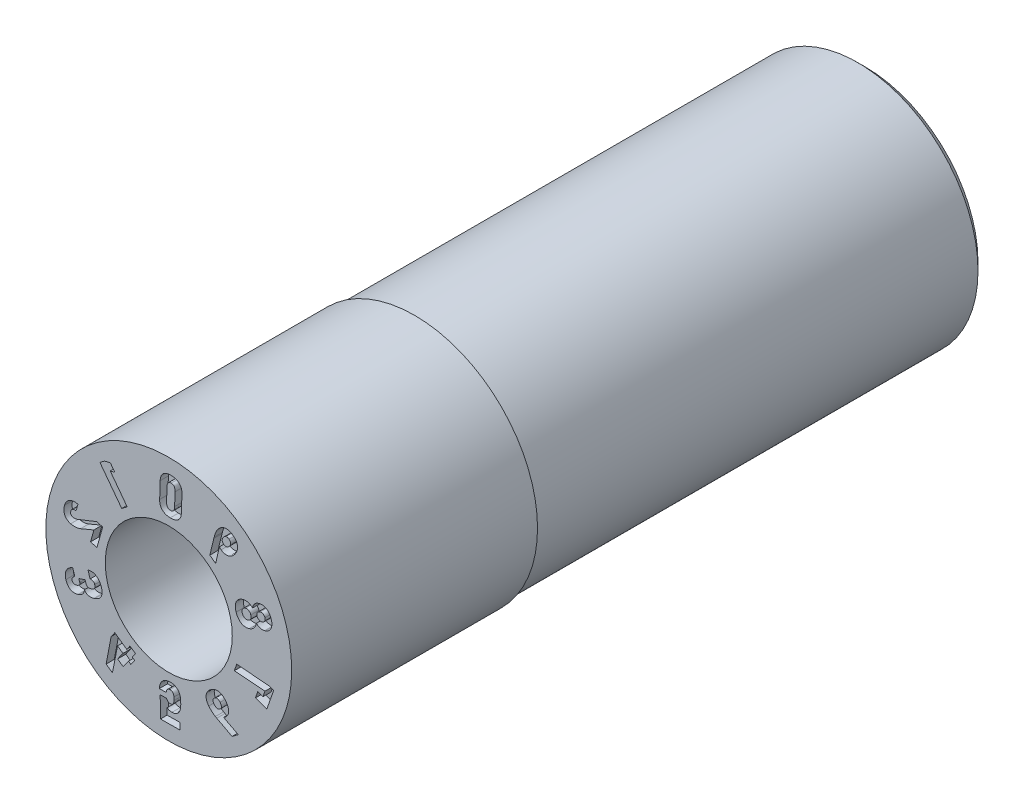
SolidWorks part; units mm, degrees
ref_plane "Front Plane" through (0, 0, 0) normal (0, 0, 1) x (1, 0, 0)
ref_plane "Top Plane" through (0, 0, 0) normal (0, 1, 0) x (1, 0, 0)
ref_plane "Right Plane" through (0, 0, 0) normal (1, 0, 0) x (0, 0, -1)
sketch "Sketch1" plane through (0, 0, 0) normal (1, 0, 0) x (0, 0, -1)
  line L2 (0, 3) -> (0, 1.55)
  line L3 (16.75, 3) -> (0, 3)
  line L4 (-3.7979, 0) -> (49996.2021, 0) construction
  line L8 (14, 0.8) -> (2.8, 0.8)
  line L9 (2.8, 1.55) -> (2.8, 0.8)
  line L10 (2.8, 1.55) -> (0, 1.55)
  line L12 (17, 1.5) -> (17, 2.75)
  line L16 (17, 2.75) -> (16.75, 3)
  line L17 (17, 1.5) -> (14, 1.5)
  line L18 (14, 0.8) -> (14, 1.5)
  dimension "D1" = 17
  dimension "D2" = 45
  dimension "D3" = 0.25
  dimension "D4" = 6
  dimension "D5" = 3.1
  dimension "D6" = 2.8
  dimension "D7" = 1.6
  dimension "D8" = 3
  dimension "D9" = 3
revolve "Revolve1" add sketch "Sketch1" angle 360 about L4
sketch "Sketch4" plane through (0, 0, 0) normal (1, 0, 0) x (0, 0, -1)
  line L0 (0, 0) -> (50000, 0) construction
  line L1 (17, -2.75) -> (17, 2.75) construction
  line L2 (6, 3.935) -> (17, 3.935)
  line L3 (6, 3.935) -> (6, 2.935)
  line L4 (6, 2.935) -> (17, 2.935)
  line L5 (17, 3.935) -> (17, 2.935)
  line L6 (16.75, 3) -> (0, 3) construction
  line L9 (0, 55) -> (0, -55) construction
  dimension "D1" = 1
  dimension "D2" = 0.065
  dimension "D3" = 6
revolve "Cut-Revolve1" cut sketch "Sketch4" angle 360 about L0
sketch "Sketch2" plane through (0, 0, 0) normal (0, 0, 1) x (1, 0, 0)
  line L0 (0, 3.7423) -> (0, 0) construction
  line L1 (2.1997, 3.0276) -> (0, 0) construction
  line L2 (3.5591, 1.1564) -> (0, 0) construction
  line L3 (3.5591, -1.1564) -> (0, 0) construction
  line L4 (2.1997, -3.0276) -> (0, 0) construction
  line L5 (0, -3.7423) -> (0, 0) construction
  line L6 (-2.1997, -3.0276) -> (0, 0) construction
  line L7 (-3.5591, -1.1564) -> (0, 0) construction
  line L8 (-3.5591, 1.1564) -> (0, 0) construction
  line L9 (-2.1997, 3.0276) -> (0, 0) construction
  line L10 (1.9646, 0.3603) -> (1.9783, 0.3649)
  line L11 (2.3396, 0.5043) -> (2.3614, 0.5117)
  line L12 (2.1957, 1.0088) -> (2.1739, 1.0014)
  line L13 (1.8012, 0.8965) -> (1.7875, 0.8918)
  line L14 (1.8631, 0.7416) -> (1.8712, 0.7443)
  line L15 (1.9425, 0.5285) -> (1.9338, 0.5256)
  line L16 (2.2203, 0.8413) -> (2.2282, 0.8439)
  line L17 (2.2879, 0.6627) -> (2.2792, 0.6598)
  line L18 (-1.0256, -1.574) -> (-1.3171, -1.3669)
  line L19 (1.614, 1.759) -> (1.6145, 1.7595)
  line L20 (1.1924, 2.0656) -> (1.1921, 2.0653)
  line L21 (1.0993, 1.8332) -> (1.0018, 1.4312)
  line L22 (1.0018, 1.4312) -> (1.145, 1.3261)
  line L23 (1.145, 1.3261) -> (1.2344, 1.7241)
  line L24 (1.332, 1.9723) -> (1.3324, 1.9728)
  line L25 (1.4816, 1.8624) -> (1.4812, 1.8618)
  line L26 (0.3085, 1.9801) -> (0.3215, 2.3834)
  line L27 (-0.2092, 2.4005) -> (-0.2221, 1.9973)
  line L28 (-0.0536, 2.0347) -> (-0.0433, 2.3524)
  line L29 (0.153, 2.3462) -> (0.1427, 2.0284)
  line L30 (-1.1478, 1.3435) -> (-1.0146, 1.4437)
  line L31 (-1.0146, 1.4437) -> (-1.4288, 1.9942)
  line L32 (-1.4288, 1.9942) -> (-1.3183, 2.0264)
  line L33 (-1.3183, 2.0264) -> (-1.4248, 2.1678)
  line L34 (-1.4248, 2.1678) -> (-1.5662, 2.1362)
  line L35 (-1.5662, 2.1362) -> (-1.68, 2.0505)
  line L36 (-1.68, 2.0505) -> (-1.1478, 1.3435)
  line L37 (-1.7573, 0.7596) -> (-2.2252, 0.5745)
  line L38 (-2.341, 0.5619) -> (-2.3422, 0.5622)
  line L39 (-2.2634, 0.7349) -> (-2.2627, 0.7346)
  line L40 (-2.2627, 0.7346) -> (-2.2164, 0.8998)
  line L41 (-2.2164, 0.8998) -> (-2.2171, 0.9)
  line L42 (-2.3935, 0.398) -> (-2.3928, 0.3977)
  line L43 (-2.152, 0.4133) -> (-1.8273, 0.5491)
  line L44 (-1.8273, 0.5491) -> (-1.9093, 0.257)
  line L45 (-1.9093, 0.257) -> (-1.7541, 0.2134)
  line L46 (-1.7541, 0.2134) -> (-1.6121, 0.7188)
  line L47 (-1.6121, 0.7188) -> (-1.7573, 0.7596)
  line L48 (-1.9727, -0.3677) -> (-1.9191, -0.5323)
  line L49 (-1.8737, -0.7209) -> (-1.8936, -0.7273)
  line L50 (-2.0193, -0.6828) -> (-2.0426, -0.6111)
  line L51 (-2.0426, -0.6111) -> (-2.1963, -0.6611)
  line L52 (-2.1963, -0.6611) -> (-2.173, -0.7328)
  line L53 (-2.2397, -0.8247) -> (-2.2541, -0.8294)
  line L54 (-2.2928, -0.669) -> (-2.3462, -0.5049)
  line L55 (-2.2148, -1.0057) -> (-2.189, -0.9973)
  line L56 (-1.8257, -0.8946) -> (-1.8, -0.8862)
  line L57 (-1.4061, -1.492) -> (-1.5288, -2.1359)
  line L58 (-1.5288, -2.1359) -> (-1.3748, -2.2452)
  line L59 (-1.3748, -2.2452) -> (-1.2504, -1.6116)
  line L60 (-1.2504, -1.6116) -> (-1.1187, -1.7051)
  line L61 (-0.9261, -1.8421) -> (-0.8329, -1.7109)
  line L62 (-0.8329, -1.7109) -> (-0.8896, -1.6707)
  line L63 (-1.3171, -1.3669) -> (-1.4061, -1.492)
  line L64 (-1.2486, -1.8878) -> (-1.1126, -1.9845)
  line L65 (-1.1126, -1.9845) -> (-0.9828, -1.8018)
  line L66 (-0.8105, -1.5594) -> (-0.9465, -1.4627)
  line L67 (-0.9465, -1.4627) -> (-1.0256, -1.574)
  line L68 (-0.23, -2.0036) -> (-0.23, -2.0042)
  line L69 (-0.23, -2.0042) -> (-0.0627, -2.0022)
  line L70 (-0.0627, -2.0022) -> (-0.0627, -2.0017)
  line L71 (0.1247, -2.0061) -> (0.1256, -2.0805)
  line L72 (-0.0528, -2.1224) -> (-0.2091, -2.1242)
  line L73 (-0.2091, -2.1242) -> (-0.2029, -2.6344)
  line L74 (-0.2029, -2.6344) -> (0.2738, -2.6287)
  line L75 (0.2738, -2.6287) -> (0.2719, -2.4676)
  line L76 (0.2719, -2.4676) -> (-0.0376, -2.4713)
  line L77 (-0.0376, -2.4713) -> (-0.0394, -2.3145)
  line L78 (0.2927, -2.0785) -> (0.2918, -2.0042)
  line L79 (0.9754, -1.7698) -> (0.9758, -1.7704)
  line L80 (1.1719, -1.9302) -> (1.5442, -2.1282)
  line L81 (1.5442, -2.1282) -> (1.6957, -2.0151)
  line L82 (1.6957, -2.0151) -> (1.3383, -1.8295)
  line L83 (-1.1187, -1.7051) -> (-1.2486, -1.8878)
  line L84 (1.3929, -1.4625) -> (1.3925, -1.462)
  line L85 (1.2526, -1.5536) -> (1.253, -1.5541)
  line L86 (1.1047, -1.664) -> (1.1043, -1.6635)
  line L87 (2.4557, -0.6107) -> (1.6591, -0.5429)
  line L88 (1.6591, -0.5429) -> (1.5995, -0.7135)
  line L89 (1.5995, -0.7135) -> (2.3471, -0.7708)
  line L90 (2.3471, -0.7708) -> (2.2969, -0.9145)
  line L91 (2.2969, -0.9145) -> (2.171, -0.8706)
  line L92 (2.171, -0.8706) -> (2.116, -1.0281)
  line L93 (2.116, -1.0281) -> (2.3936, -1.1249)
  line L94 (2.3936, -1.1249) -> (2.5604, -0.6471)
  line L95 (2.5604, -0.6471) -> (2.4557, -0.6107)
  line L96 (-0.9828, -1.8018) -> (-0.9261, -1.8421)
  line L97 (-0.8896, -1.6707) -> (-0.8105, -1.5594)
  circle A0 centre (0, 0) radius 1.7759 construction
  spline S0 degree 3 poles (1.643, 0.5484) (1.6514, 0.5233) (1.6669, 0.4876) (1.6945, 0.4451) (1.7177, 0.418) (1.7429, 0.3946) (1.7705, 0.3758) (1.7999, 0.3613) (1.831, 0.3515) (1.8634, 0.3462) (1.9087, 0.3456) (1.9426, 0.3531) (1.9646, 0.3603) knots 0 0 0 0 0.189149 0.276864 0.361539 0.443576 0.522394 0.599725 0.677022 0.754789 0.833795 1 1 1 1
  spline S1 degree 3 poles (1.9783, 0.3649) (1.999, 0.3717) (2.0286, 0.3863) (2.0628, 0.414) (2.0857, 0.4384) (2.1052, 0.4657) (2.1263, 0.5048) (2.1349, 0.5371) (2.1379, 0.5589) knots 0 0 0 0 0.246977 0.370172 0.497924 0.625566 0.750117 1 1 1 1
  spline S2 degree 3 poles (2.1379, 0.5589) (2.1511, 0.5454) (2.1734, 0.528) (2.207, 0.5111) (2.2334, 0.502) (2.2605, 0.4964) (2.2964, 0.4941) (2.3228, 0.4988) (2.3396, 0.5043) knots 0 0 0 0 0.257134 0.383027 0.511099 0.637625 0.759671 1 1 1 1
  spline S3 degree 3 poles (2.3614, 0.5117) (2.3821, 0.5188) (2.4119, 0.5322) (2.4458, 0.5582) (2.4672, 0.5806) (2.4854, 0.6054) (2.4993, 0.633) (2.5096, 0.6626) (2.5156, 0.6942) (2.5178, 0.7275) (2.5151, 0.7748) (2.5063, 0.8102) (2.4986, 0.8335) knots 0 0 0 0 0.16714 0.246142 0.324291 0.402157 0.479801 0.558525 0.640149 0.724487 0.812253 1 1 1 1
  spline S4 degree 3 poles (2.4986, 0.8335) (2.4907, 0.8569) (2.4765, 0.8905) (2.4503, 0.93) (2.4286, 0.9553) (2.4048, 0.977) (2.3788, 0.9945) (2.3511, 1.008) (2.3218, 1.0172) (2.2912, 1.0221) (2.2485, 1.0224) (2.2165, 1.0157) (2.1957, 1.0088) knots 0 0 0 0 0.188263 0.275658 0.360332 0.441745 0.520456 0.597882 0.675873 0.753814 0.833078 1 1 1 1
  spline S5 degree 3 poles (2.1739, 1.0014) (2.1568, 0.996) (2.1329, 0.9832) (2.1049, 0.96) (2.0869, 0.9389) (2.0712, 0.9156) (2.0551, 0.8815) (2.048, 0.854) (2.0459, 0.8351) knots 0 0 0 0 0.242123 0.364086 0.490249 0.617698 0.743096 1 1 1 1
  spline S6 degree 3 poles (2.0459, 0.8351) (2.0303, 0.8511) (2.0037, 0.8718) (1.9632, 0.891) (1.9311, 0.9013) (1.8982, 0.9074) (1.8543, 0.9092) (1.8219, 0.9032) (1.8012, 0.8965) knots 0 0 0 0 0.252199 0.377454 0.505058 0.631379 0.754394 1 1 1 1
  spline S7 degree 3 poles (1.7875, 0.8918) (1.7655, 0.8844) (1.734, 0.8699) (1.698, 0.8423) (1.6753, 0.8186) (1.6562, 0.7921) (1.6414, 0.7629) (1.631, 0.7313) (1.6243, 0.6975) (1.6222, 0.6619) (1.6255, 0.6113) (1.6345, 0.5734) (1.643, 0.5484) knots 0 0 0 0 0.166586 0.245064 0.32325 0.400569 0.477895 0.55635 0.638171 0.723193 0.810971 1 1 1 1
  spline S8 degree 3 poles (1.7953, 0.5991) (1.792, 0.6091) (1.7884, 0.6244) (1.7879, 0.6449) (1.7891, 0.6596) (1.7924, 0.6736) (1.7974, 0.6868) (1.8045, 0.6989) (1.8131, 0.7102) (1.8236, 0.7203) (1.8397, 0.7319) (1.8533, 0.7386) (1.8631, 0.7416) knots 0 0 0 0 0.178659 0.263512 0.345804 0.426862 0.506071 0.58371 0.664092 0.745271 0.827853 1 1 1 1
  spline S9 degree 3 poles (1.8712, 0.7443) (1.8801, 0.7473) (1.8939, 0.7502) (1.9122, 0.7497) (1.9253, 0.7474) (1.9379, 0.7433) (1.9499, 0.7374) (1.961, 0.7298) (1.9714, 0.7206) (1.9806, 0.7096) (1.9922, 0.6927) (1.9982, 0.6781) (2.0017, 0.668) knots 0 0 0 0 0.166218 0.24509 0.322722 0.400755 0.478423 0.557267 0.638758 0.723097 0.810568 1 1 1 1
  spline S10 degree 3 poles (2.0017, 0.668) (2.0049, 0.6578) (2.0089, 0.6425) (2.0099, 0.622) (2.0089, 0.6077) (2.0064, 0.5939) (2.0019, 0.581) (1.9958, 0.5691) (1.988, 0.5582) (1.9788, 0.5485) (1.9642, 0.5373) (1.9515, 0.5314) (1.9425, 0.5285) knots 0 0 0 0 0.188381 0.275514 0.359781 0.441669 0.521149 0.598996 0.676873 0.75539 0.833936 1 1 1 1
  spline S11 degree 3 poles (1.9338, 0.5256) (1.9241, 0.5223) (1.9093, 0.5192) (1.8895, 0.5188) (1.8754, 0.5209) (1.8618, 0.5247) (1.8491, 0.5304) (1.8371, 0.5377) (1.8263, 0.5471) (1.8165, 0.5579) (1.8053, 0.5749) (1.7985, 0.589) (1.7953, 0.5991) knots 0 0 0 0 0.173702 0.255121 0.336326 0.416102 0.493685 0.572899 0.653754 0.736097 0.820278 1 1 1 1
  spline S12 degree 3 poles (2.1551, 0.719) (2.1522, 0.7275) (2.1493, 0.7406) (2.1491, 0.7581) (2.1507, 0.7705) (2.1542, 0.7823) (2.1589, 0.7936) (2.1656, 0.8039) (2.1737, 0.8137) (2.1834, 0.8223) (2.1985, 0.8326) (2.2112, 0.8384) (2.2203, 0.8413) knots 0 0 0 0 0.173002 0.255064 0.334564 0.413146 0.490488 0.568625 0.649591 0.733329 0.818008 1 1 1 1
  spline S13 degree 3 poles (2.2282, 0.8439) (2.2367, 0.8466) (2.2494, 0.8496) (2.2664, 0.8498) (2.2785, 0.8484) (2.2899, 0.8452) (2.3007, 0.8406) (2.3108, 0.8345) (2.32, 0.8267) (2.3283, 0.8177) (2.3384, 0.8035) (2.3435, 0.7912) (2.3465, 0.7828) knots 0 0 0 0 0.177307 0.259345 0.339545 0.418685 0.496491 0.574446 0.653742 0.736205 0.819476 1 1 1 1
  spline S14 degree 3 poles (2.3465, 0.7828) (2.3492, 0.7742) (2.3526, 0.7612) (2.3528, 0.7438) (2.3517, 0.7315) (2.3488, 0.7199) (2.3446, 0.7088) (2.3386, 0.6986) (2.331, 0.6893) (2.3221, 0.6809) (2.3083, 0.6707) (2.2962, 0.6656) (2.2879, 0.6627) knots 0 0 0 0 0.179779 0.264113 0.345718 0.425073 0.502738 0.58081 0.660047 0.741093 0.823978 1 1 1 1
  spline S15 degree 3 poles (2.2792, 0.6598) (2.2705, 0.657) (2.257, 0.6539) (2.2391, 0.6533) (2.2263, 0.6543) (2.2143, 0.6573) (2.2028, 0.6616) (2.1923, 0.6676) (2.1825, 0.6752) (2.1737, 0.6841) (2.1635, 0.6982) (2.1581, 0.7105) (2.1551, 0.719) knots 0 0 0 0 0.179106 0.264699 0.346614 0.427117 0.504294 0.583324 0.662147 0.74231 0.825294 1 1 1 1
  spline S16 degree 3 poles (1.2344, 1.7241) (1.2348, 1.7235) (1.239, 1.7181) (1.252, 1.7028) (1.267, 1.6904) (1.2775, 1.6825) knots 0.564808 0.564808 0.564808 0.564808 0.581367 0.712724 1 1 1 1
  spline S17 degree 3 poles (1.2775, 1.6825) (1.2947, 1.6699) (1.3224, 1.6543) (1.3621, 1.6421) (1.3921, 1.6378) (1.4222, 1.6379) (1.4522, 1.6427) (1.4819, 1.6516) (1.5109, 1.665) (1.539, 1.6826) (1.5756, 1.7122) (1.5995, 1.7393) (1.614, 1.759) knots 0 0 0 0 0.164897 0.243134 0.320511 0.39795 0.475691 0.554489 0.636785 0.722171 0.810484 1 1 1 1
  spline S18 degree 3 poles (1.6145, 1.7595) (1.6301, 1.7813) (1.651, 1.8146) (1.6694, 1.862) (1.6778, 1.8961) (1.6813, 1.9297) (1.6794, 1.9624) (1.6728, 1.9943) (1.6608, 2.025) (1.6443, 2.0548) (1.6146, 2.0936) (1.5862, 2.1184) (1.5655, 2.1337) knots 0 0 0 0 0.187702 0.272979 0.354472 0.432702 0.508274 0.583207 0.65927 0.738162 0.82033 1 1 1 1
  spline S19 degree 3 poles (1.5655, 2.1337) (1.5449, 2.1486) (1.5128, 2.1683) (1.4668, 2.1845) (1.4334, 2.1915) (1.4002, 2.1934) (1.3676, 2.19) (1.3356, 2.1814) (1.3044, 2.168) (1.2742, 2.1495) (1.2344, 2.1172) (1.2082, 2.0876) (1.1924, 2.0656) knots 0 0 0 0 0.177888 0.259816 0.338331 0.414817 0.490131 0.565735 0.64425 0.726092 0.811434 1 1 1 1
  spline S20 degree 3 poles (1.1921, 2.0653) (1.1828, 2.0528) (1.1702, 2.0324) (1.1554, 2.0034) (1.145, 1.9794) (1.1352, 1.9539) (1.122, 1.9169) (1.114, 1.8879) (1.1084, 1.8681) knots 0 0 0 0 0.216887 0.332679 0.453535 0.580869 0.713539 1 1 1 1
  spline S21 degree 3 poles (1.1084, 1.8681) (1.1065, 1.8623) (1.1035, 1.8506) (1.1003, 1.839) (1.0993, 1.8332) knots 0 0 0 0 0.506531 1 1 1 1
  spline S22 degree 3 poles (1.3422, 1.8296) (1.3315, 1.8374) (1.3172, 1.8514) (1.3065, 1.8748) (1.303, 1.8931) (1.304, 1.9124) (1.3111, 1.9403) (1.323, 1.9597) (1.332, 1.9723) knots 0 0 0 0 0.246295 0.358616 0.470672 0.58763 0.712559 1 1 1 1
  spline S23 degree 3 poles (1.3324, 1.9728) (1.3412, 1.985) (1.3561, 2.0008) (1.3797, 2.0156) (1.3975, 2.0214) (1.4157, 2.0232) (1.4409, 2.0195) (1.4585, 2.0105) (1.4691, 2.0024) knots 0 0 0 0 0.283785 0.405908 0.522128 0.634955 0.748097 1 1 1 1
  spline S24 degree 3 poles (1.4691, 2.0024) (1.4799, 1.9945) (1.4944, 1.9806) (1.5054, 1.9573) (1.5089, 1.9392) (1.5083, 1.9204) (1.5017, 1.8933) (1.4902, 1.8746) (1.4816, 1.8624) knots 0 0 0 0 0.252476 0.366872 0.479602 0.595681 0.718088 1 1 1 1
  spline S25 degree 3 poles (1.4812, 1.8618) (1.4719, 1.8495) (1.4571, 1.8323) (1.4326, 1.8175) (1.4146, 1.8107) (1.3962, 1.8088) (1.3706, 1.8122) (1.3529, 1.8215) (1.3422, 1.8296) knots 0 0 0 0 0.286977 0.411209 0.527402 0.638802 0.751662 1 1 1 1
  spline S26 degree 3 poles (0.0349, 1.7367) (0.0554, 1.7362) (0.0853, 1.7368) (0.1236, 1.7427) (0.1496, 1.7493) (0.1738, 1.7579) (0.1961, 1.7687) (0.2166, 1.7816) (0.2351, 1.7968) (0.2515, 1.8139) (0.2659, 1.8327) (0.2783, 1.8531) (0.2886, 1.8753) (0.2968, 1.8992) (0.305, 1.9341) (0.308, 1.9614) (0.3085, 1.9801) knots 0 0 0 0 0.147137 0.214358 0.278606 0.339919 0.398926 0.456935 0.513792 0.570649 0.626987 0.684089 0.742428 0.802687 0.865483 1 1 1 1
  spline S27 degree 3 poles (0.3215, 2.3834) (0.3219, 2.4022) (0.3214, 2.43) (0.315, 2.4655) (0.3084, 2.49) (0.2997, 2.5129) (0.2887, 2.5341) (0.2755, 2.5538) (0.26, 2.5716) (0.2424, 2.5878) (0.2228, 2.602) (0.2012, 2.6141) (0.1777, 2.6243) (0.1522, 2.6323) (0.1144, 2.6404) (0.0847, 2.6432) (0.0644, 2.6439) knots 0 0 0 0 0.135819 0.198843 0.259322 0.317796 0.3747 0.43116 0.487607 0.544517 0.602364 0.661319 0.722276 0.78613 0.853499 1 1 1 1
  spline S28 degree 3 poles (0.0644, 2.6439) (0.044, 2.6444) (0.014, 2.644) (-0.0242, 2.6378) (-0.0503, 2.6319) (-0.0744, 2.623) (-0.0968, 2.6125) (-0.1172, 2.5998) (-0.1357, 2.5848) (-0.1522, 2.5679) (-0.1667, 2.5493) (-0.1789, 2.5287) (-0.1893, 2.5066) (-0.1974, 2.4825) (-0.2061, 2.4473) (-0.2084, 2.4195) (-0.2092, 2.4005) knots 0 0 0 0 0.146922 0.214045 0.277959 0.339182 0.3979 0.455579 0.512067 0.568196 0.624703 0.681512 0.739766 0.800352 0.863566 1 1 1 1
  spline S29 degree 3 poles (-0.2221, 1.9973) (-0.2226, 1.9784) (-0.2221, 1.9507) (-0.2157, 1.9151) (-0.2091, 1.8907) (-0.2004, 1.8678) (-0.1892, 1.8467) (-0.1759, 1.827) (-0.1605, 1.809) (-0.1429, 1.7929) (-0.1235, 1.7786) (-0.1018, 1.7666) (-0.0783, 1.7564) (-0.0528, 1.7484) (-0.015, 1.7403) (0.0146, 1.7375) (0.0349, 1.7367) knots 0 0 0 0 0.135853 0.198892 0.259386 0.317476 0.37461 0.431085 0.487863 0.544787 0.602288 0.661258 0.722634 0.786504 0.853463 1 1 1 1
  spline S30 degree 3 poles (0.0402, 1.8978) (0.0323, 1.8983) (0.0207, 1.8991) (0.0063, 1.9037) (-0.0035, 1.9075) (-0.0121, 1.9129) (-0.0202, 1.9189) (-0.0271, 1.9264) (-0.0354, 1.9377) (-0.0435, 1.9547) (-0.0534, 1.9879) (-0.0537, 2.0156) (-0.0536, 2.0347) knots 0 0 0 0 0.125945 0.183291 0.238413 0.291967 0.344823 0.3983 0.452118 0.567781 0.695223 1 1 1 1
  spline S31 degree 3 poles (-0.0433, 2.3524) (-0.0425, 2.3715) (-0.0401, 2.399) (-0.0283, 2.4315) (-0.0189, 2.4479) (-0.0099, 2.4586) (-0.0025, 2.4656) (0.0059, 2.4711) (0.0149, 2.4761) (0.0249, 2.4794) (0.0396, 2.4825) (0.0512, 2.4833) (0.0591, 2.4829) knots 0 0 0 0 0.304248 0.431958 0.547131 0.601686 0.654466 0.707868 0.761045 0.816491 0.873821 1 1 1 1
  spline S32 degree 3 poles (0.0591, 2.4829) (0.0671, 2.4829) (0.0786, 2.4812) (0.0931, 2.4773) (0.1027, 2.473) (0.1117, 2.4681) (0.1194, 2.4616) (0.1265, 2.4544) (0.1348, 2.443) (0.1431, 2.4261) (0.1525, 2.3928) (0.1532, 2.3653) (0.153, 2.3462) knots 0 0 0 0 0.126048 0.183166 0.238633 0.292583 0.345235 0.398052 0.45322 0.568053 0.695199 1 1 1 1
  spline S33 degree 3 poles (0.1427, 2.0284) (0.142, 2.0093) (0.1392, 1.9819) (0.1279, 1.9491) (0.1184, 1.9328) (0.1094, 1.9219) (0.1018, 1.9152) (0.0936, 1.9094) (0.0844, 1.9049) (0.0745, 1.9012) (0.0597, 1.8982) (0.0481, 1.8973) (0.0402, 1.8978) knots 0 0 0 0 0.303869 0.432041 0.54707 0.601557 0.654952 0.707519 0.76099 0.81672 0.873978 1 1 1 1
  spline S34 degree 3 poles (-2.2252, 0.5745) (-2.245, 0.5667) (-2.2706, 0.5594) (-2.3015, 0.5576) (-2.3197, 0.5573) (-2.3327, 0.5599) (-2.341, 0.5619) knots 0 0 0 0 0.540719 0.665819 0.783787 1 1 1 1
  spline S35 degree 3 poles (-2.3422, 0.5622) (-2.3526, 0.5652) (-2.3673, 0.5719) (-2.3822, 0.5865) (-2.3899, 0.5996) (-2.3949, 0.6144) (-2.397, 0.6379) (-2.3938, 0.6561) (-2.3903, 0.6684) knots 0 0 0 0 0.245533 0.356637 0.46917 0.585599 0.709489 1 1 1 1
  spline S36 degree 3 poles (-2.3903, 0.6684) (-2.3867, 0.6806) (-2.379, 0.6983) (-2.3615, 0.7162) (-2.3461, 0.7265) (-2.3283, 0.7334) (-2.3005, 0.739) (-2.2784, 0.7369) (-2.2634, 0.7349) knots 0 0 0 0 0.241005 0.354164 0.46819 0.587648 0.713238 1 1 1 1
  spline S37 degree 3 poles (-2.2171, 0.9) (-2.2426, 0.9054) (-2.2807, 0.91) (-2.3306, 0.9073) (-2.3651, 0.901) (-2.3975, 0.8906) (-2.4273, 0.8761) (-2.4545, 0.8578) (-2.4791, 0.8357) (-2.5005, 0.8098) (-2.5256, 0.7701) (-2.5386, 0.7365) (-2.5452, 0.7132) knots 0 0 0 0 0.185279 0.271235 0.354096 0.434334 0.512208 0.589109 0.666944 0.746227 0.827242 1 1 1 1
  spline S38 degree 3 poles (-2.5452, 0.7132) (-2.5522, 0.6883) (-2.5596, 0.6513) (-2.5611, 0.6027) (-2.5583, 0.5695) (-2.5513, 0.5386) (-2.5402, 0.51) (-2.525, 0.4841) (-2.506, 0.4608) (-2.4832, 0.4403) (-2.4469, 0.4162) (-2.4155, 0.4041) (-2.3935, 0.398) knots 0 0 0 0 0.195042 0.283139 0.36646 0.445986 0.522022 0.596986 0.671869 0.748307 0.827593 1 1 1 1
  spline S39 degree 3 poles (-2.3928, 0.3977) (-2.3734, 0.3923) (-2.3435, 0.3867) (-2.3028, 0.3845) (-2.2717, 0.3854) (-2.2407, 0.3885) (-2.2001, 0.396) (-2.1709, 0.4056) (-2.152, 0.4133) knots 0 0 0 0 0.245803 0.370307 0.497524 0.625183 0.750822 1 1 1 1
  spline S40 degree 3 poles (-1.6475, -0.5618) (-1.6554, -0.5375) (-1.6702, -0.5027) (-1.6968, -0.461) (-1.7193, -0.4339) (-1.7442, -0.4104) (-1.7714, -0.3908) (-1.801, -0.3756) (-1.8325, -0.3643) (-1.8659, -0.3578) (-1.9132, -0.3552) (-1.9491, -0.3613) (-1.9727, -0.3677) knots 0 0 0 0 0.181239 0.266564 0.349497 0.429986 0.508511 0.586299 0.665102 0.745038 0.826222 1 1 1 1
  spline S41 degree 3 poles (-1.9191, -0.5323) (-1.9105, -0.5306) (-1.8977, -0.5296) (-1.8811, -0.5305) (-1.8696, -0.533) (-1.8588, -0.5365) (-1.8489, -0.5414) (-1.8398, -0.5474) (-1.8315, -0.5546) (-1.8242, -0.563) (-1.8151, -0.5758) (-1.8106, -0.587) (-1.808, -0.5947) knots 0 0 0 0 0.186215 0.271746 0.354623 0.435117 0.513799 0.58974 0.667057 0.745561 0.826556 1 1 1 1
  spline S42 degree 3 poles (-1.808, -0.5947) (-1.8039, -0.6082) (-1.7994, -0.629) (-1.8032, -0.6558) (-1.8099, -0.6735) (-1.8205, -0.689) (-1.8406, -0.7075) (-1.86, -0.7164) (-1.8737, -0.7209) knots 0 0 0 0 0.265552 0.38416 0.498069 0.612278 0.730215 1 1 1 1
  spline S43 degree 3 poles (-1.8936, -0.7273) (-1.908, -0.7321) (-1.9293, -0.7368) (-1.9569, -0.7363) (-1.9746, -0.7323) (-1.9899, -0.7249) (-2.0076, -0.71) (-2.0155, -0.6939) (-2.0193, -0.6828) knots 0 0 0 0 0.300175 0.428716 0.546215 0.657116 0.764967 1 1 1 1
  spline S44 degree 3 poles (-2.173, -0.7328) (-2.1699, -0.742) (-2.1683, -0.7565) (-2.1731, -0.7751) (-2.1806, -0.7875) (-2.1908, -0.7992) (-2.2101, -0.8132) (-2.2272, -0.8209) (-2.2397, -0.8247) knots 0 0 0 0 0.226275 0.333176 0.444771 0.564289 0.694381 1 1 1 1
  spline S45 degree 3 poles (-2.2541, -0.8294) (-2.2657, -0.8331) (-2.2831, -0.8372) (-2.3058, -0.8354) (-2.3204, -0.8313) (-2.3333, -0.8241) (-2.3481, -0.8102) (-2.3552, -0.796) (-2.3585, -0.7861) knots 0 0 0 0 0.287214 0.411059 0.528164 0.640053 0.753005 1 1 1 1
  spline S46 degree 3 poles (-2.3585, -0.7861) (-2.3609, -0.7792) (-2.3626, -0.7684) (-2.3622, -0.7538) (-2.3602, -0.7431) (-2.3568, -0.7324) (-2.3517, -0.7221) (-2.3456, -0.712) (-2.3378, -0.7024) (-2.3285, -0.6933) (-2.3141, -0.6811) (-2.3014, -0.6738) (-2.2928, -0.669) knots 0 0 0 0 0.149486 0.221379 0.296505 0.372837 0.450101 0.530551 0.614358 0.702677 0.796538 1 1 1 1
  spline S47 degree 3 poles (-2.3462, -0.5049) (-2.3697, -0.5152) (-2.4035, -0.5329) (-2.4421, -0.564) (-2.4666, -0.5891) (-2.4869, -0.6166) (-2.5035, -0.6454) (-2.5152, -0.6762) (-2.5232, -0.708) (-2.5267, -0.741) (-2.5253, -0.7864) (-2.5186, -0.8202) (-2.5112, -0.8421) knots 0 0 0 0 0.185633 0.272058 0.356309 0.437961 0.517155 0.595271 0.674069 0.753305 0.833466 1 1 1 1
  spline S48 degree 3 poles (-2.5112, -0.8421) (-2.5052, -0.8598) (-2.4955, -0.8854) (-2.4784, -0.9164) (-2.465, -0.9371) (-2.4498, -0.9554) (-2.4338, -0.9718) (-2.4162, -0.9858) (-2.3976, -0.9976) (-2.3778, -1.0072) (-2.357, -1.0142) (-2.3353, -1.0191) (-2.3128, -1.021) (-2.2894, -1.021) (-2.2563, -1.0173) (-2.2314, -1.0111) (-2.2148, -1.0057) knots 0 0 0 0 0.145426 0.211954 0.275969 0.337025 0.396649 0.454146 0.511619 0.568302 0.625199 0.682179 0.740634 0.800913 0.863712 1 1 1 1
  spline S49 degree 3 poles (-2.189, -0.9973) (-2.1706, -0.9911) (-2.1441, -0.9791) (-2.1144, -0.9553) (-2.0959, -0.9348) (-2.0807, -0.9116) (-2.065, -0.8769) (-2.0598, -0.8482) (-2.0587, -0.8287) knots 0 0 0 0 0.257453 0.378339 0.499528 0.620736 0.742394 1 1 1 1
  spline S50 degree 3 poles (-2.0587, -0.8287) (-2.0532, -0.8379) (-2.0441, -0.8507) (-2.0297, -0.8658) (-2.0182, -0.8756) (-2.006, -0.8845) (-1.9928, -0.8916) (-1.9788, -0.8979) (-1.964, -0.9029) (-1.9485, -0.9064) (-1.9324, -0.9088) (-1.9158, -0.9096) (-1.8988, -0.9095) (-1.8812, -0.9076) (-1.8566, -0.9036) (-1.8381, -0.8986) (-1.8257, -0.8946) knots 0 0 0 0 0.120906 0.178849 0.236287 0.292916 0.349744 0.407439 0.46679 0.527209 0.588325 0.65104 0.716198 0.78243 0.851785 1 1 1 1
  spline S51 degree 3 poles (-1.8, -0.8862) (-1.7772, -0.8785) (-1.7442, -0.865) (-1.7067, -0.8384) (-1.6829, -0.8167) (-1.6634, -0.7922) (-1.648, -0.7654) (-1.6371, -0.736) (-1.6304, -0.7046) (-1.628, -0.6712) (-1.6305, -0.6227) (-1.6397, -0.5862) (-1.6475, -0.5618) knots 0 0 0 0 0.177932 0.259254 0.337713 0.414056 0.489085 0.564851 0.643296 0.725035 0.810871 1 1 1 1
  spline S52 degree 3 poles (0.0268, -1.7349) (0.004, -1.7351) (-0.0298, -1.7392) (-0.0722, -1.753) (-0.1016, -1.7672) (-0.1287, -1.7851) (-0.1531, -1.8066) (-0.1742, -1.832) (-0.1926, -1.8606) (-0.2077, -1.8923) (-0.2233, -1.9397) (-0.2287, -1.9777) (-0.23, -2.0036) knots 0 0 0 0 0.16524 0.244417 0.322805 0.400846 0.478672 0.557836 0.639473 0.724039 0.811488 1 1 1 1
  spline S53 degree 3 poles (-0.0627, -2.0017) (-0.0612, -1.9869) (-0.0575, -1.9655) (-0.0455, -1.9404) (-0.0344, -1.9251) (-0.021, -1.9127) (0.0003, -1.9006) (0.0187, -1.8972) (0.0312, -1.8972) knots 0 0 0 0 0.286183 0.411742 0.532404 0.64841 0.759975 1 1 1 1
  spline S54 degree 3 poles (0.0312, -1.8972) (0.0444, -1.897) (0.0641, -1.8998) (0.0866, -1.9122) (0.1005, -1.9248) (0.1111, -1.941) (0.1223, -1.9676) (0.1241, -1.9905) (0.1247, -2.0061) knots 0 0 0 0 0.245066 0.356152 0.46929 0.586116 0.709914 1 1 1 1
  spline S55 degree 3 poles (0.1256, -2.0805) (0.1258, -2.0961) (0.124, -2.1186) (0.115, -2.1457) (0.1057, -2.1619) (0.0938, -2.1747) (0.074, -2.1873) (0.0564, -2.1908) (0.0445, -2.1908) knots 0 0 0 0 0.303731 0.432422 0.551077 0.661791 0.769201 1 1 1 1
  spline S56 degree 3 poles (0.0445, -2.1908) (0.0332, -2.1911) (0.0167, -2.1891) (-0.0037, -2.1815) (-0.0172, -2.1736) (-0.0292, -2.1637) (-0.0426, -2.1472) (-0.0497, -2.1328) (-0.0528, -2.1224) knots 0 0 0 0 0.263351 0.385352 0.506994 0.627815 0.747381 1 1 1 1
  spline S57 degree 3 poles (-0.0394, -2.3145) (-0.0326, -2.3208) (-0.0208, -2.3292) (-0.0028, -2.3376) (0.028, -2.3487) (0.0556, -2.3528) (0.0776, -2.3526) knots 0 0 0 0 0.220054 0.342992 0.474745 1 1 1 1
  spline S58 degree 3 poles (0.0776, -2.3526) (0.0992, -2.3526) (0.1308, -2.3484) (0.1699, -2.3347) (0.1958, -2.3203) (0.2188, -2.3021) (0.2388, -2.2801) (0.2559, -2.2547) (0.2698, -2.2256) (0.2804, -2.1933) (0.2908, -2.1441) (0.2931, -2.1052) (0.2927, -2.0785) knots 0 0 0 0 0.163783 0.239793 0.313915 0.387533 0.461673 0.538418 0.619509 0.705405 0.7969 1 1 1 1
  spline S59 degree 3 poles (0.2918, -2.0042) (0.2916, -1.9774) (0.2877, -1.9384) (0.2742, -1.8896) (0.2603, -1.8574) (0.2427, -1.8286) (0.2216, -1.8034) (0.197, -1.782) (0.1689, -1.7645) (0.1377, -1.7507) (0.0904, -1.7377) (0.0527, -1.7343) (0.0268, -1.7349) knots 0 0 0 0 0.186985 0.272083 0.353195 0.431301 0.506888 0.582003 0.658173 0.737112 0.819706 1 1 1 1
  spline S60 degree 3 poles (1.0227, -1.4006) (1.0025, -1.4159) (0.9743, -1.4406) (0.9455, -1.4794) (0.9289, -1.5088) (0.9172, -1.5393) (0.9106, -1.5709) (0.9091, -1.6032) (0.9124, -1.6362) (0.9209, -1.6697) (0.9391, -1.7161) (0.9597, -1.7487) (0.9754, -1.7698) knots 0 0 0 0 0.180375 0.262965 0.341848 0.418458 0.494125 0.569404 0.64731 0.728323 0.813375 1 1 1 1
  spline S61 degree 3 poles (0.9758, -1.7704) (0.9855, -1.7838) (1.0021, -1.8028) (1.0262, -1.8272) (1.0674, -1.8641) (1.1053, -1.8916) (1.1376, -1.911) knots 0 0 0 0 0.230263 0.351032 0.476028 1 1 1 1
  spline S62 degree 3 poles (1.1376, -1.911) (1.1433, -1.9145) (1.1548, -1.9207) (1.1661, -1.9274) (1.1719, -1.9302) knots 0 0 0 0 0.508117 1 1 1 1
  spline S63 degree 3 poles (1.3383, -1.8295) (1.3481, -1.8247) (1.3573, -1.819) (1.3661, -1.8125) knots 0.758295 0.758295 0.758295 0.758295 1 1 1 1
  spline S64 degree 3 poles (1.3661, -1.8125) (1.3844, -1.799) (1.4092, -1.7762) (1.4345, -1.7408) (1.4484, -1.7134) (1.4578, -1.6847) (1.4621, -1.6549) (1.4621, -1.6241) (1.4573, -1.5924) (1.448, -1.5602) (1.4285, -1.5153) (1.4086, -1.4832) (1.3929, -1.4625) knots 0 0 0 0 0.1717 0.250621 0.326851 0.40171 0.476669 0.552996 0.632938 0.716617 0.805049 1 1 1 1
  spline S65 degree 3 poles (1.3925, -1.462) (1.3768, -1.4406) (1.3506, -1.4119) (1.3114, -1.3803) (1.2814, -1.3626) (1.2505, -1.3495) (1.2187, -1.3418) (1.1865, -1.3388) (1.1538, -1.3411) (1.1208, -1.3486) (1.0751, -1.3653) (1.0434, -1.3857) (1.0227, -1.4006) knots 0 0 0 0 0.186909 0.27204 0.353373 0.431715 0.507453 0.582297 0.658656 0.737405 0.81992 1 1 1 1
  spline S66 degree 3 poles (1.119, -1.5295) (1.1295, -1.5213) (1.1469, -1.512) (1.1718, -1.5073) (1.1896, -1.5085) (1.207, -1.5137) (1.2299, -1.5272) (1.2442, -1.5421) (1.2526, -1.5536) knots 0 0 0 0 0.259581 0.374842 0.488467 0.603269 0.724091 1 1 1 1
  spline S67 degree 3 poles (1.253, -1.5541) (1.263, -1.567) (1.2748, -1.5874) (1.2836, -1.616) (1.2849, -1.6358) (1.2822, -1.6546) (1.2715, -1.6783) (1.2578, -1.6929) (1.2469, -1.7008) knots 0 0 0 0 0.293579 0.419449 0.536383 0.647405 0.758677 1 1 1 1
  spline S68 degree 3 poles (1.2469, -1.7008) (1.2362, -1.7083) (1.2187, -1.7184) (1.1929, -1.7205) (1.174, -1.7179) (1.1555, -1.7105) (1.1301, -1.6946) (1.1144, -1.6769) (1.1047, -1.664) knots 0 0 0 0 0.239637 0.349766 0.46244 0.581193 0.70678 1 1 1 1
  spline S69 degree 3 poles (1.1043, -1.6635) (1.0958, -1.6522) (1.0853, -1.6344) (1.0793, -1.6087) (1.0793, -1.5907) (1.0833, -1.5735) (1.0945, -1.551) (1.1085, -1.5374) (1.119, -1.5295) knots 0 0 0 0 0.277361 0.398057 0.513445 0.626018 0.741743 1 1 1 1
  point P15 (0, 0)
  dimension "D1" = 10
extrude "Cut-Extrude1" cut sketch "Sketch2" against normal blind 0.2
sketch "Sketch3" plane through (0, 0, -2.8) normal (0, 0, 1) x (1, 0, 0)
  line L0 (0, 0) -> (0, 50000) construction
  line L1 (0.4619, 0.8) -> (-0.4619, 0.8)
  line L2 (-0.4619, 0.8) -> (-0.9238, 0)
  line L3 (-0.9238, 0) -> (-0.4619, -0.8)
  line L4 (-0.4619, -0.8) -> (0.4619, -0.8)
  line L5 (0.4619, -0.8) -> (0.9238, 0)
  line L6 (0.9238, 0) -> (0.4619, 0.8)
  line L7 (0, 0) -> (50000, 0) construction
  circle A0 centre (0, 0) radius 0.8 construction
  circle A1 centre (0, 0) radius 0.8 construction
extrude "Cut-Extrude2" cut sketch "Sketch3" against normal blind 1.4
